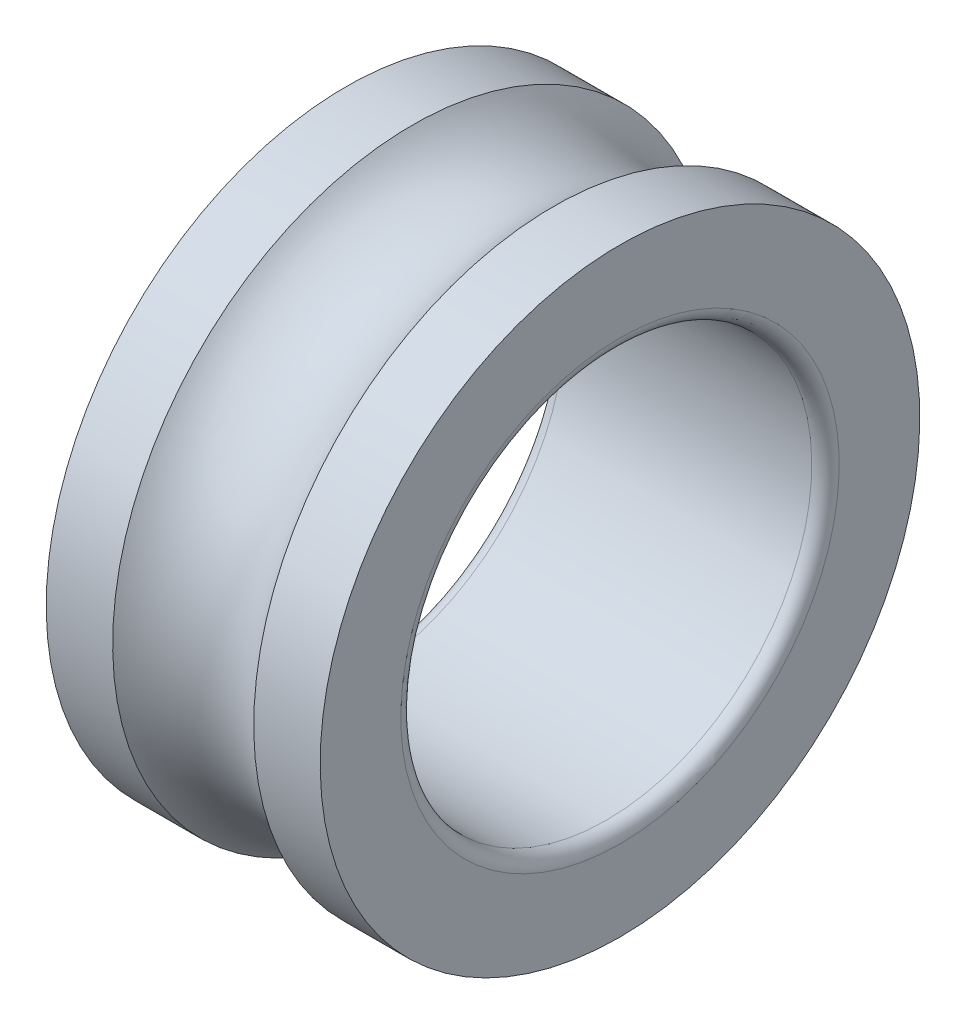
SolidWorks part; units mm, degrees
ref_plane "Plan de face" through (0, 0, 0) normal (0, 0, 1) x (1, 0, 0)
ref_plane "Plan de dessus" through (0, 0, 0) normal (0, 1, 0) x (1, 0, 0)
ref_plane "Plan de droite" through (0, 0, 0) normal (1, 0, 0) x (0, 0, -1)
sketch "Esquisse1" plane through (0, 0, 0) normal (0, 0, 1) x (1, 0, 0)
  line L0 (0, 8.754) -> (0, 6.4)
  line L1 (0.4, 6) -> (7.6, 6)
  line L2 (8, 6.4) -> (8, 8.754)
  line L3 (8, 8.754) -> (6.0595, 8.754)
  line L4 (1.9405, 8.754) -> (0, 8.754)
  line L5 (8, 0) -> (0, 0) construction
  arc A0 (0, 6.4) -> (0.4, 6) centre (0.4, 6.4) ccw
  arc A1 (7.6, 6) -> (8, 6.4) centre (7.6, 6.4) ccw
  arc A2 (6.0595, 8.754) -> (1.9405, 8.754) centre (4, 10.5) cw
revolve "Révolution1" add sketch "Esquisse1" angle 360 about L5
